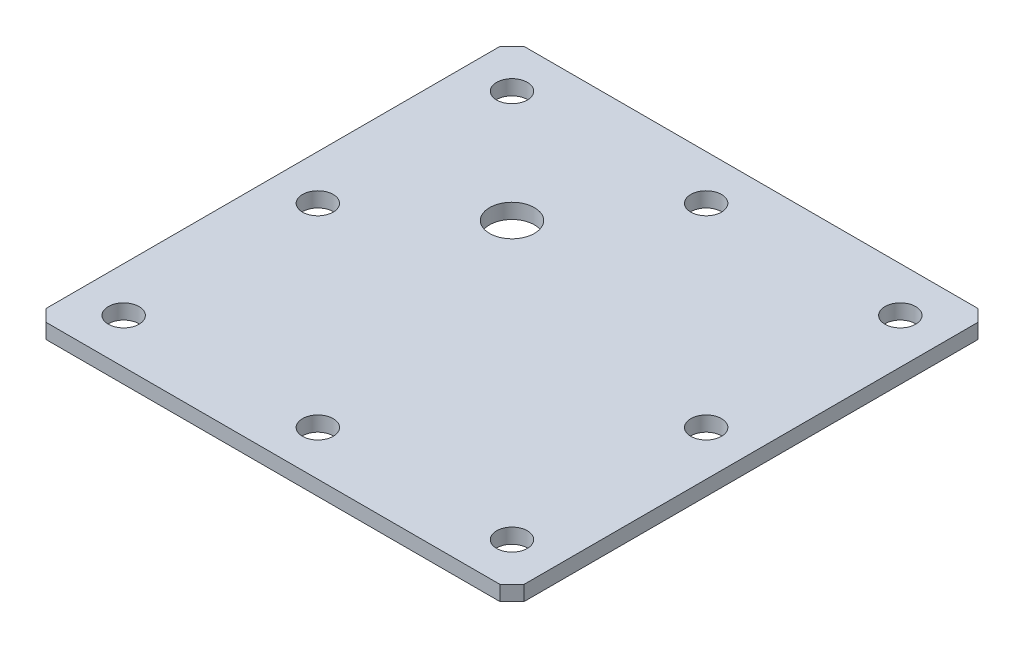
SolidWorks part; units mm, degrees
ref_plane "Front Plane" through (0, 0, 0) normal (0, 0, 1) x (1, 0, 0)
ref_plane "Top Plane" through (0, 0, 0) normal (0, 1, 0) x (1, 0, 0)
ref_plane "Right Plane" through (0, 0, 0) normal (1, 0, 0) x (0, 0, -1)
sketch "Sketch1" plane through (0, 0, 0) normal (0, 1, 0) x (1, 0, 0)
  line L0 (-49.428, 48.6342) -> (-46.888, 51.1742)
  line L1 (-46.888, -50.4258) -> (49.632, -50.4258)
  line L2 (-49.428, -47.8858) -> (-49.428, 48.6342)
  line L3 (-46.888, 51.1742) -> (49.632, 51.1742)
  line L4 (52.172, -47.8858) -> (52.172, 48.6342)
  line L5 (-49.428, -50.4258) -> (52.172, 51.1742) construction
  line L6 (-49.428, 51.1742) -> (52.172, -50.4258) construction
  line L7 (49.632, 51.1742) -> (52.172, 48.6342)
  line L8 (49.632, -50.4258) -> (52.172, -47.8858)
  line L9 (-49.428, -47.8858) -> (-46.888, -50.4258)
  line L10 (-39.903, 41.6492) -> (1.372, 41.6492)
  line L11 (42.647, -40.9008) -> (-39.903, -40.9008) construction
  line L12 (42.647, -40.9008) -> (42.647, 41.6492) construction
  line L13 (42.647, 41.6492) -> (-39.903, 41.6492) construction
  line L14 (-39.903, -40.9008) -> (-39.903, 41.6492) construction
  line L15 (42.647, -40.9008) -> (-39.903, 41.6492) construction
  line L16 (42.647, 41.6492) -> (-39.903, -40.9008) construction
  line L17 (42.647, -40.9008) -> (1.372, -40.9008)
  line L18 (-33.553, -34.5508) -> (36.297, -34.5508)
  line L19 (-33.553, -34.5508) -> (-33.553, 35.2992)
  line L20 (-33.553, 35.2992) -> (36.297, 35.2992)
  line L21 (36.297, -34.5508) -> (36.297, 35.2992)
  line L22 (-33.553, -34.5508) -> (36.297, 35.2992) construction
  line L23 (-33.553, 35.2992) -> (36.297, -34.5508) construction
  line L24 (-49.428, 17.8367) -> (-16.0905, 17.8367) construction
  line L25 (-16.0905, 17.8367) -> (-16.0905, 51.1742) construction
  circle A0 centre (-39.903, 41.6492) radius 3.2639
  circle A1 centre (1.372, 41.6492) radius 3.2639
  circle A2 centre (42.647, 41.6492) radius 3.2639
  circle A3 centre (42.647, 0.3742) radius 3.2639
  circle A4 centre (42.647, -40.9008) radius 3.2639
  circle A5 centre (1.372, -40.9008) radius 3.2639
  circle A6 centre (-39.903, -40.9008) radius 3.2639
  circle A7 centre (-39.903, 0.3742) radius 3.2639
  circle A9 centre (22.0095, -40.9008) radius 4.7625 construction
  circle A10 centre (-16.0905, 17.8367) radius 4.7625
  point P0 (1.372, 0.3742)
  point P13 (1.372, 0.3742)
  point P34 (1.372, 0.3742)
  dimension "D13" = 6.5278
  dimension "D14" = 9.525
  dimension "D1" = 101.6
  dimension "D2" = 101.6
  dimension "D3" = 2.54
  dimension "D4" = 2.54
  dimension "D5" = 2.54
  dimension "D6" = 2.54
  dimension "D7" = 2.54
  dimension "D8" = 2.54
  dimension "D9" = 2.54
  dimension "D10" = 2.54
  dimension "D11" = 82.55
  dimension "D12" = 82.55
  dimension "D15" = 69.85
  dimension "D16" = 69.85
  dimension "D17" = 33.3375
  dimension "D18" = 33.3375
extrude "Boss-Extrude1" add sketch "Sketch1" along normal blind 3.175
